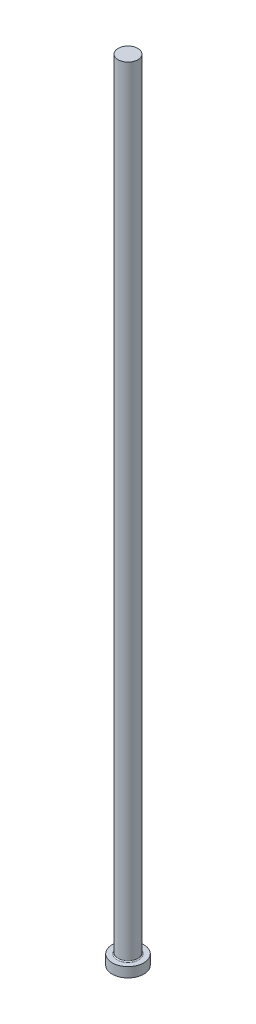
SolidWorks part; units mm, degrees
ref_plane "Plano frontal" through (0, 0, 0) normal (0, 0, 1) x (1, 0, 0)
ref_plane "Plano superior" through (0, 0, 0) normal (0, 1, 0) x (1, 0, 0)
ref_plane "Plano direito" through (0, 0, 0) normal (1, 0, 0) x (0, 0, -1)
sketch "Esboço1" plane through (0, 0, 0) normal (0, 0, 1) x (1, 0, 0)
  line L0 (0, 0) -> (8, 0)
  line L1 (8, 0) -> (8, 5)
  line L2 (8, 5) -> (5.5, 5)
  line L3 (5, 5.5) -> (5, 400)
  line L4 (5, 400) -> (0, 400)
  line L5 (0, 400) -> (0, 0) construction
  line L6 (0, 0) -> (0, 400)
  arc A0 (5.5, 5) -> (5, 5.5) centre (5.5, 5.5) cw
  dimension "D3" = 0.5
  dimension "D1" = 16
  dimension "D2" = 10
  dimension "D4" = 5
  dimension "D5" = 400
revolve "Revolução1" add sketch "Esboço1" angle 360 about L5
sketch "Esboço2"
  dimension "D1" = 0.9
  dimension "D2" = 1.4
  dimension "D3" = 4.3
  dimension "D4" = 0.6
wrap "Envolver1" sketch "Esboço2" wrap type deboss source sketch "Esboço2" thickness 0.1 parameters "D1"=0.1
